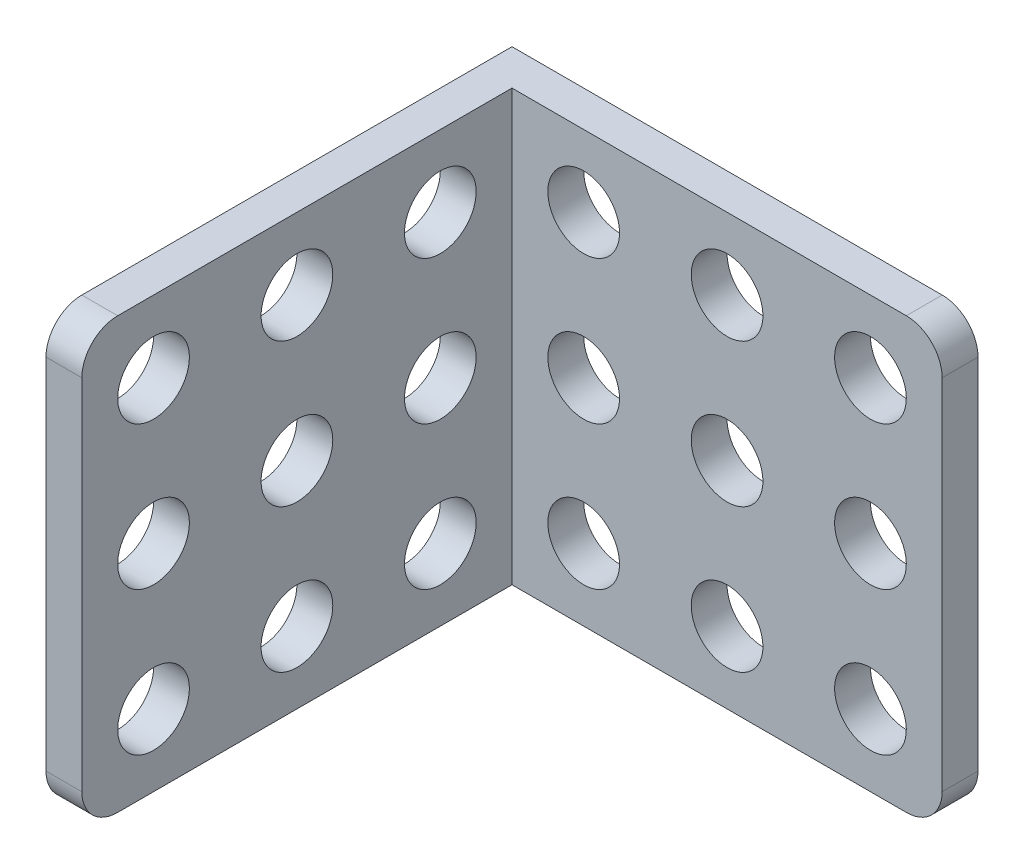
SolidWorks part; units mm, degrees
ref_plane "前视基准面" through (0, 0, 0) normal (0, 0, 1) x (1, 0, 0)
ref_plane "上视基准面" through (0, 0, 0) normal (0, 1, 0) x (1, 0, 0)
ref_plane "右视基准面" through (0, 0, 0) normal (1, 0, 0) x (0, 0, -1)
sketch "草图1" plane through (0, 0, 0) normal (0, 0, 1) x (1, 0, 0)
  line L1 (-13, 12) -> (13, 12)
  line L2 (-13, 12) -> (-13, -12)
  line L3 (-13, -12) -> (13, -12)
  line L4 (13, 12) -> (13, -12)
  line L5 (-13, 12) -> (13, -12) construction
  line L6 (-13, -12) -> (13, 12) construction
  point P0 (0, 0)
  dimension "D1" = 24
  dimension "D2" = 26
extrude "凸台-拉伸1" add sketch "草图1" along normal blind 2
sketch "草图2" plane through (0, 0, 2) normal (0, 0, 1) x (1, 0, 0)
  line L0 (-13, -12) -> (13, -12) construction
  line L1 (-13, 12) -> (-11, 12)
  line L2 (-13, 12) -> (-13, -12)
  line L3 (-13, -12) -> (-11, -12)
  line L4 (-11, 12) -> (-11, -12)
  dimension "D1" = 2
extrude "凸台-拉伸2" add sketch "草图2" along normal blind 24
fillet "圆角1" radius 2 4 edges at (13, -12, 1) (13, 12, 1) (-12, 12, 26) (-12, -12, 26)
hole_wizard "Ø4.0 (4) 直径孔1" positions "草图3" profile "草图4" hole size "Ø4.0" standard "GB"
sketch "草图3" plane through (-11, 0, 0) normal (1, 0, 0) x (0, 0, -1)
  line L0 (-26, -10) -> (-26, 10) construction
  line L1 (-24, 12) -> (-2, 12) construction
  point P0 (-6, 0)
  point P2 (-14, 0)
  point P4 (-22, 0)
  point P6 (-22, 8)
  point P8 (-14, 8)
  point P10 (-6, 8)
  point P12 (-6, -8)
  point P14 (-14, -8)
  point P16 (-22, -8)
  point P19 (0, 0)
  point P20 (0, 0)
  point P21 (0, 0)
  point P22 (0, 0)
  point P23 (0, 0)
  dimension "D1" = 12
  dimension "D2" = 12
  dimension "D3" = 16
  dimension "D4" = 8
  dimension "D5" = 16
  dimension "D6" = 8
sketch "草图4" plane through (-11, 0, 6) normal (0, 1, 0) x (0, 0, -1)
  line L0 (0, 0) -> (0, 2)
  line L1 (0, 2) -> (2, 2)
  line L2 (2, 2) -> (2, 0)
  line L5 (2, 0) -> (0, 0)
  line L11 (0, -6.35) -> (0, 107.95) construction
  dimension "通孔孔直径" = 4
  dimension "通孔孔深度" = 2
ref_plane "基准面1" through (-6.5, 0, 6.5) normal (0.7071, 0, -0.7071) x (-0.7071, 0, -0.7071)
mirror "镜向1" about plane through (-6.5, 0, 6.5) normal (0.7071, 0, -0.7071) of "Ø4.0 (4) 直径孔1"
